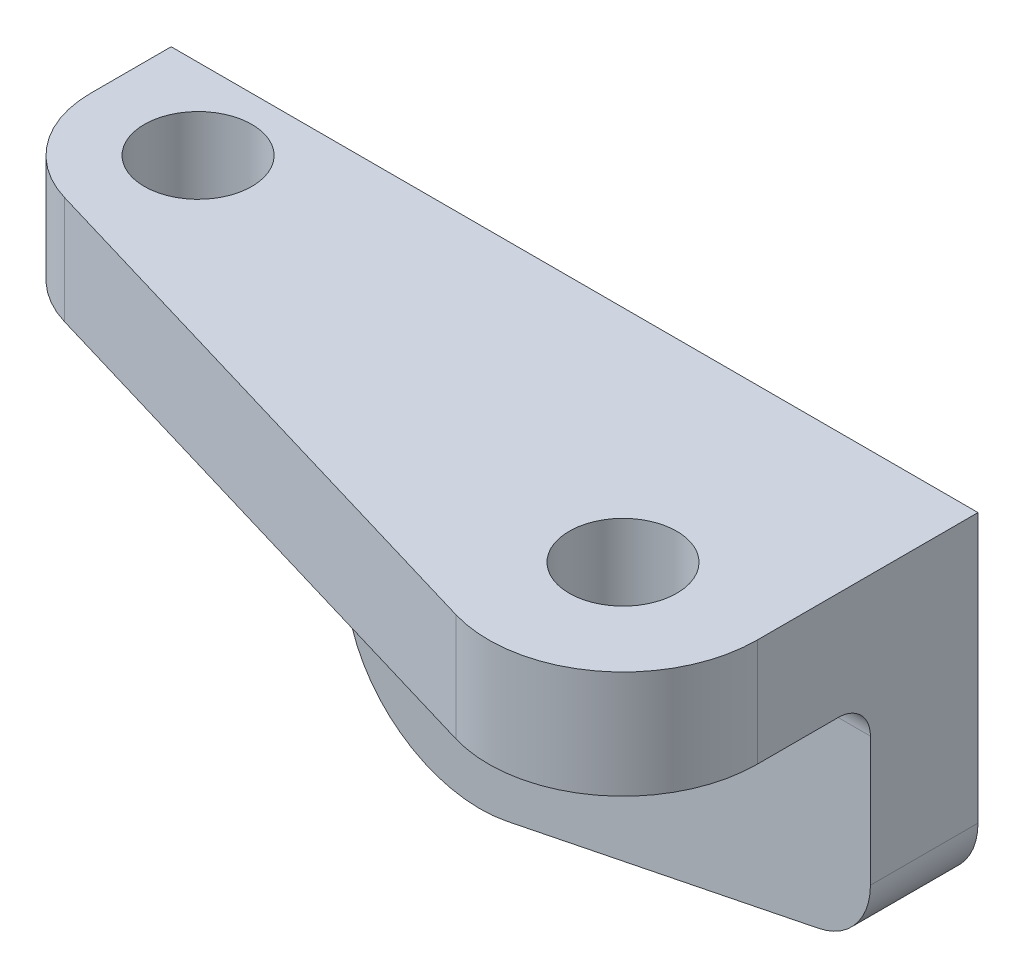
SolidWorks part; units mm, degrees
ref_plane "Alzado" through (0, 0, 0) normal (0, 0, 1) x (1, 0, 0)
ref_plane "Planta" through (0, 0, 0) normal (0, 1, 0) x (1, 0, 0)
ref_plane "Vista lateral" through (0, 0, 0) normal (1, 0, 0) x (0, 0, -1)
sketch "Sketch1" plane through (0, 0, 0) normal (0, 1, 0) x (1, 0, 0)
  line L2 (-75, -15) -> (-75, 0)
  line L3 (-75, 0) -> (75, 0)
  line L4 (75, -41) -> (75, 0)
  line L7 (-60.6994, -34.1707) -> (42.8757, -64.9634)
  arc A3 (42.8757, -64.9634) -> (75, -41) centre (50, -41) ccw
  arc A4 (-75, -15) -> (-60.6994, -34.1707) centre (-55, -15) ccw
  circle A5 centre (-55, -15) radius 10
  circle A6 centre (50, -41) radius 10
  point P0 (0, 0)
  point P7 (0, 0)
  dimension "D3" = 20
  dimension "D4" = 25
  dimension "D6" = 20
  dimension "D7" = 20
  dimension "D1" = 150
  dimension "D2" = 41
  dimension "D5" = 15
extrude "Boss-Extrude1" add sketch "Sketch1" along normal blind 20
sketch "Sketch2" plane through (0, 0, 0) normal (0, 0, -1) x (-1, 0, 0)
  line L0 (-75, 0) -> (75, 0) construction
  line L1 (-75, 0) -> (22.5794, 0)
  line L2 (-75, 0) -> (-75, -30)
  line L3 (-65.381, -41.7614) -> (-7.381, -53.503)
  line L4 (22.5794, 0) -> (22.5794, -29)
  line L5 (-75, 20) -> (-75, 0) construction
  arc A0 (-7.381, -53.503) -> (22.5794, -29) centre (-2.4206, -29) ccw
  arc A1 (-75, -30) -> (-65.381, -41.7614) centre (-63, -30) ccw
  circle A2 centre (-2.4206, -29) radius 9
  dimension "D4" = 58
  dimension "D1" = 12
  dimension "D2" = 25
  dimension "D6" = 18
  dimension "D3" = 29
  dimension "D5" = 30
extrude "Boss-Extrude2" add sketch "Sketch2" against normal blind 20
fillet "Fillet1" radius 6 1 edges at (-22.5794, 0, 10)
fillet "Fillet2" radius 6 1 edges at (23.2103, 0, 20)
